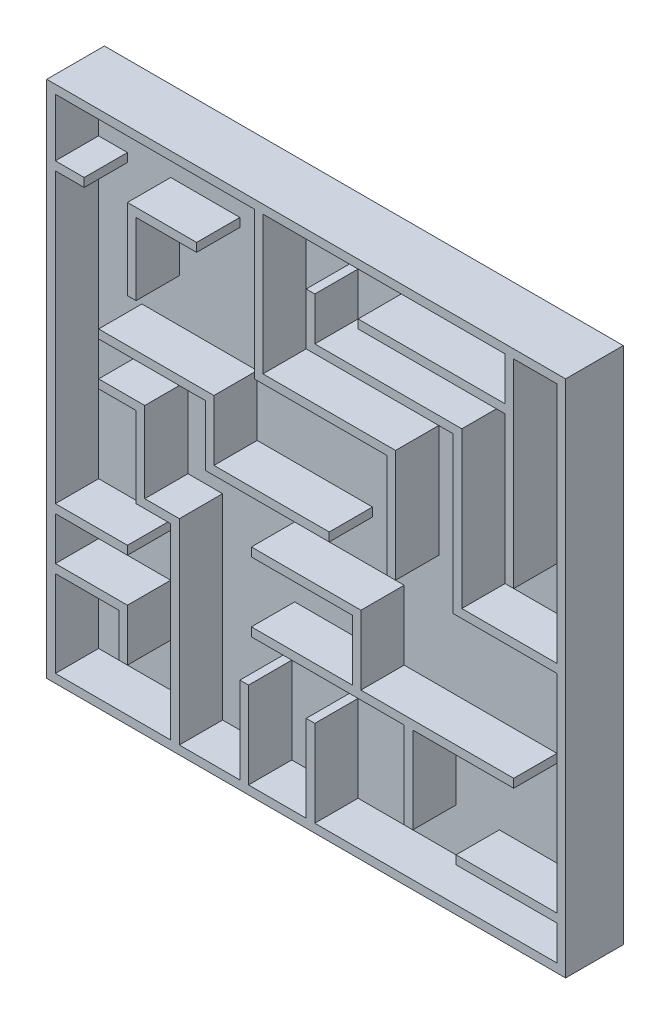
SolidWorks part; units mm, degrees
ref_plane "Ebene vorne" through (0, 0, 0) normal (0, 0, 1) x (1, 0, 0)
ref_plane "Ebene oben" through (0, 0, 0) normal (0, 1, 0) x (1, 0, 0)
ref_plane "Ebene rechts" through (0, 0, 0) normal (1, 0, 0) x (0, 0, -1)
sketch "Skizze1" plane through (0, 0, 0) normal (0, 0, 1) x (1, 0, 0)
  line L1 (0, 0) -> (180, 0)
  line L2 (0, 0) -> (0, 180)
  line L3 (0, 180) -> (180, 180)
  line L4 (180, 0) -> (180, 180)
  dimension "D1" = 180
  dimension "D2" = 180
extrude "Aufsatz-Linear austragen1" add sketch "Skizze1" along normal blind 5
sketch "Skizze2" plane through (0, 0, 5) normal (0, 0, 1) x (1, 0, 0)
  line L0 (0, 0) -> (180, 0) construction
  line L1 (0, 180) -> (3, 180)
  line L2 (0, 180) -> (0, 0)
  line L3 (0, 0) -> (3, 0)
  line L4 (3, 180) -> (3, 0)
  line L5 (90, 180) -> (90, 0) construction
  line L6 (180, 180) -> (0, 180)
  line L7 (180, 180) -> (180, 177)
  line L8 (180, 177) -> (0, 177)
  line L9 (0, 180) -> (0, 177)
  line L10 (0, 90) -> (180, 90) construction
  line L11 (180, 0) -> (180, 180) construction
  line L12 (180, 0) -> (0, 0)
  line L13 (180, 0) -> (177, 0)
  line L14 (177, 180) -> (177, 0)
  line L15 (180, 180) -> (177, 180)
  line L16 (180, 180) -> (180, 0)
  line L17 (180, 3) -> (0, 3)
  line L18 (0, 0) -> (0, 3)
  line L19 (180, 0) -> (0, 0)
  line L20 (180, 0) -> (180, 3)
  line L22 (162, 177) -> (159, 177)
  line L23 (162, 177) -> (162, 108)
  line L24 (162, 108) -> (159, 108)
  line L25 (159, 177) -> (159, 108)
  line L26 (177, 90) -> (141, 90)
  line L27 (177, 90) -> (177, 93)
  line L28 (177, 93) -> (141, 93)
  line L29 (141, 90) -> (141, 93)
  line L30 (141, 93) -> (144, 93)
  line L31 (141, 93) -> (141, 144)
  line L32 (141, 144) -> (144, 144)
  line L33 (144, 93) -> (144, 144)
  line L34 (144, 144) -> (90, 144)
  line L35 (144, 144) -> (144, 147)
  line L36 (144, 147) -> (90, 147)
  line L37 (90, 144) -> (90, 147)
  line L38 (90, 147) -> (93, 147)
  line L39 (90, 147) -> (90, 162)
  line L40 (90, 162) -> (93, 162)
  line L41 (93, 147) -> (93, 162)
  line L42 (159, 162) -> (108, 162)
  line L43 (159, 162) -> (159, 159)
  line L44 (159, 159) -> (108, 159)
  line L45 (108, 162) -> (108, 159)
  line L46 (75, 177) -> (72, 177)
  line L47 (75, 177) -> (75, 126)
  line L48 (75, 126) -> (72, 126)
  line L49 (72, 177) -> (72, 126)
  line L50 (75, 126) -> (118, 126)
  line L51 (75, 126) -> (75, 129)
  line L52 (75, 129) -> (118, 129)
  line L53 (118, 126) -> (118, 129)
  line L54 (118, 129) -> (121, 129)
  line L55 (118, 129) -> (118, 90)
  line L56 (118, 90) -> (121, 90)
  line L57 (121, 129) -> (121, 90)
  line L58 (121, 90) -> (126, 90)
  line L59 (121, 90) -> (121, 93)
  line L60 (121, 93) -> (126, 93)
  line L61 (126, 90) -> (126, 93)
  line L62 (177, 18) -> (142, 18)
  line L63 (177, 18) -> (177, 15)
  line L64 (177, 15) -> (142, 15)
  line L65 (142, 18) -> (142, 15)
  line L66 (127, 18) -> (124, 18)
  line L67 (127, 18) -> (127, 51)
  line L68 (127, 51) -> (124, 51)
  line L69 (124, 18) -> (124, 51)
  line L70 (127, 51) -> (162, 51)
  line L71 (127, 51) -> (127, 48)
  line L72 (127, 48) -> (162, 48)
  line L73 (162, 51) -> (162, 48)
  line L74 (124, 51) -> (106, 51)
  line L75 (124, 51) -> (124, 48)
  line L76 (124, 48) -> (106, 48)
  line L77 (106, 51) -> (106, 48)
  line L78 (106, 51) -> (109, 51)
  line L79 (106, 51) -> (106, 75)
  line L80 (106, 75) -> (109, 75)
  line L81 (109, 51) -> (109, 75)
  line L82 (90, 3) -> (93, 3)
  line L83 (90, 3) -> (90, 33)
  line L84 (90, 33) -> (93, 33)
  line L85 (93, 3) -> (93, 33)
  line L86 (106, 48) -> (71, 48)
  line L87 (106, 48) -> (106, 51)
  line L88 (106, 51) -> (71, 51)
  line L89 (71, 48) -> (71, 51)
  line L90 (106, 75) -> (71, 75)
  line L91 (106, 75) -> (106, 72)
  line L92 (106, 72) -> (71, 72)
  line L93 (71, 75) -> (71, 72)
  line L94 (43, 3) -> (46, 3)
  line L95 (43, 3) -> (43, 68)
  line L96 (43, 68) -> (46, 68)
  line L97 (46, 3) -> (46, 68)
  line L98 (46, 68) -> (31, 68)
  line L99 (46, 68) -> (46, 71)
  line L100 (46, 71) -> (31, 71)
  line L101 (31, 68) -> (31, 71)
  line L102 (31, 71) -> (34, 71)
  line L103 (31, 71) -> (31, 96)
  line L104 (31, 96) -> (34, 96)
  line L105 (34, 71) -> (34, 96)
  line L106 (34, 96) -> (18, 96)
  line L107 (34, 96) -> (34, 99)
  line L108 (34, 99) -> (18, 99)
  line L109 (18, 96) -> (18, 99)
  line L110 (3, 54) -> (28, 54)
  line L111 (3, 54) -> (3, 51)
  line L112 (3, 51) -> (28, 51)
  line L113 (28, 54) -> (28, 51)
  line L114 (3, 36) -> (28, 36)
  line L115 (3, 36) -> (3, 33)
  line L116 (3, 33) -> (28, 33)
  line L117 (28, 36) -> (28, 33)
  line L118 (28, 33) -> (25, 33)
  line L119 (28, 33) -> (28, 18)
  line L120 (28, 18) -> (25, 18)
  line L121 (25, 33) -> (25, 18)
  line L122 (70, 3) -> (67, 3)
  line L123 (70, 3) -> (70, 33)
  line L124 (70, 33) -> (67, 33)
  line L125 (67, 3) -> (67, 33)
  line L126 (3, 157) -> (13, 157)
  line L127 (3, 157) -> (3, 154)
  line L128 (3, 154) -> (13, 154)
  line L129 (13, 157) -> (13, 154)
  line L130 (52, 157) -> (28, 157)
  line L131 (52, 157) -> (52, 154)
  line L132 (52, 154) -> (28, 154)
  line L133 (28, 157) -> (28, 154)
  line L134 (28, 154) -> (31, 154)
  line L135 (28, 154) -> (28, 129)
  line L136 (28, 129) -> (31, 129)
  line L137 (31, 154) -> (31, 129)
  line L138 (18, 114) -> (58, 114)
  line L139 (18, 114) -> (18, 111)
  line L140 (18, 111) -> (58, 111)
  line L141 (58, 114) -> (58, 111)
  line L142 (55, 111) -> (58, 111)
  line L143 (55, 111) -> (55, 90)
  line L144 (55, 90) -> (58, 90)
  line L145 (58, 111) -> (58, 90)
  line L146 (58, 90) -> (98, 90)
  line L147 (58, 90) -> (58, 93)
  line L148 (58, 93) -> (98, 93)
  line L149 (98, 90) -> (98, 93)
  point P131 (52, 155.5)
  point P132 (0, 0)
  dimension "D1" = 3
  dimension "D2" = 3
  dimension "D3" = 3
  dimension "D4" = 15
  dimension "D5" = 15
  dimension "D6" = 3
  dimension "D7" = 3
  dimension "D8" = 15
  dimension "D9" = 3
  dimension "D10" = 15
  dimension "D11" = 15
  dimension "D12" = 3
  dimension "D13" = 15
  dimension "D14" = 3
  dimension "D15" = 3
  dimension "D16" = 15
  dimension "D17" = 15
  dimension "D18" = 3
  dimension "D19" = 3
  dimension "D20" = 3
  dimension "D21" = 15
  dimension "D22" = 0
  dimension "D23" = 15
  dimension "D24" = 3
  dimension "D25" = 3
  dimension "D26" = 3
  dimension "D27" = 3
  dimension "D28" = 15
  dimension "D29" = 15
  dimension "D30" = 15
  dimension "D31" = 3
  dimension "D32" = 35
  dimension "D33" = 15
  dimension "D34" = 30
  dimension "D35" = 15
  dimension "D36" = 3
  dimension "D37" = 30
  dimension "D38" = 3
  dimension "D39" = 35
  dimension "D40" = 35
  dimension "D41" = 5
  dimension "D42" = 15
  dimension "D43" = 3
  dimension "D44" = 3
  dimension "D45" = 3
  dimension "D46" = 3
  dimension "D47" = 40
  dimension "D48" = 15
  dimension "D49" = 15
  dimension "D50" = 65
  dimension "D51" = 25
  dimension "D52" = 3
  dimension "D53" = 3
  dimension "D54" = 3
  dimension "D55" = 15
  dimension "D56" = 15
  dimension "D57" = 30
  dimension "D58" = 15
  dimension "D59" = 15
  dimension "D60" = 3
  dimension "D61" = 20
  dimension "D62" = 30
  dimension "D63" = 10
  dimension "D64" = 20
  dimension "D65" = 15
  dimension "D66" = 3
  dimension "D67" = 20
  dimension "D68" = 3
  dimension "D69" = 3
  dimension "D70" = 3
  dimension "D71" = 15
  dimension "D72" = 25
  dimension "D73" = 3
  dimension "D74" = 40
  dimension "D75" = 15
  dimension "D76" = 40
  dimension "D77" = 25
  dimension "D78" = 3
  dimension "D79" = 20
extrude "Aufsatz-Linear austragen2" add sketch "Skizze2" along normal blind 15 contours L17 L4 L8 L2 | L14 L6 L4 L8 | L8 L4 M10 M7 | L130 L133 L132 L131 | L137 L132 L135 L136 | L50 L53 L52 L47 | L145 L140 L143 L144 | L141 L138 L139 L140 | L109 L106 L104 L107 L108 | L100 L105 L104 L103 | L101 L98 L96 L99 L100 | L146 L149 L148 L145 | L90 L93 L92 L79 | L17 L97 L96 L95 | L113 L110 L4 L112 | L117 L114 L4 L116 | L116 L121 L120 L119 | L14 L17 L4 M8 | L4 L17 M7 M8 | L17 L85 L84 L83 | L74 L81 L80 L79 | L74 L77 L76 L69 | L89 L86 L77 L88 | L125 L17 L123 L124 | L69 L66 L67 L68 | L73 L70 L67 L72 | L62 L65 L64 L14 | L17 L16 L8 L14 | L17 L14 L12 M9 | L57 L54 L53 L55 L56 | L28 L33 L32 L31 | L29 L26 L14 L28 | L8 L25 L24 L23 | L42 L45 L44 L25 | L37 L34 L32 L35 L36 | L36 L41 L40 L39 | L8 L49 L48 L47 | L14 L8 M10 M9 | L129 L126 L4 L128
sketch "Skizze3" plane through (0, 0, 0) normal (0, 0, -1) x (-1, 0, 0)
  line L0 (-90, 0) -> (-90, 180) construction
  line L1 (0, 0) -> (-180, 0) construction
  line L2 (-180, 180) -> (0, 180) construction
  line L3 (0, 90) -> (-180, 90) construction
  line L4 (0, 180) -> (0, 0) construction
  line L5 (-180, 0) -> (-180, 180) construction
  circle A0 centre (-90, 90) radius 20
extrude "Aufsatz-Linear austragen3" add sketch "Skizze3" along normal blind 5
sketch "Skizze4" plane through (0, 0, -5) normal (0, 0, -1) x (-1, 0, 0)
  line L0 (-90, 70) -> (-90, 110)
  circle A0 centre (-90, 90) radius 20 construction
  arc A1 (-90, 70) -> (-90, 110) centre (-90, 90) ccw
revolve "Rotation1" add sketch "Skizze4" angle 180 about L0
